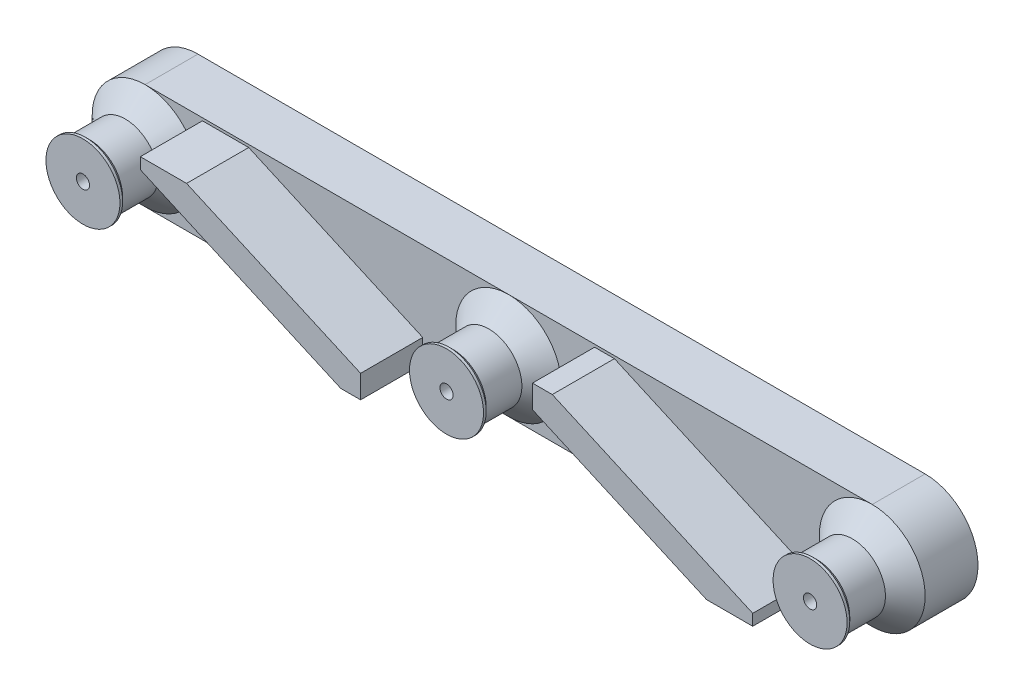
SolidWorks part; units mm, degrees
ref_plane "Alzado" through (0, 0, 0) normal (0, 0, 1) x (1, 0, 0)
ref_plane "Planta" through (0, 0, 0) normal (0, 1, 0) x (1, 0, 0)
ref_plane "Vista lateral" through (0, 0, 0) normal (1, 0, 0) x (0, 0, -1)
sketch "Sketch1" plane through (0, 0, 0) normal (0, 0, 1) x (1, 0, 0)
  line L0 (-27.5, 0) -> (27.5, 0) construction
  line L1 (-27.5, 4) -> (27.5, 4)
  line L2 (-27.5, -4) -> (27.5, -4)
  arc A0 (-27.5, 4) -> (-27.5, -4) centre (-27.5, 0) ccw
  arc A1 (27.5, -4) -> (27.5, 4) centre (27.5, 0) ccw
  point P3 (0, 0)
extrude "Boss-Extrude1" add sketch "Sketch1" along normal blind 4
sketch "Sketch2" plane through (0, 0, 4) normal (0, 0, 1) x (1, 0, 0)
  circle A0 centre (-27.5, 0) radius 4
extrude "Boss-Extrude2" add sketch "Sketch2" along normal blind 1.5
chamfer "Chamfer1" distance 1.5 angle 45 1 edges at (-23.5, 0, 5.5)
sketch "Sketch3" plane through (0, 0, 5.5) normal (0, 0, 1) x (1, 0, 0)
  circle A0 centre (-27.5, 0) radius 2.5
  circle A1 centre (-27.5, 0) radius 2.5 construction
extrude "Boss-Extrude3" add sketch "Sketch3" along normal blind 2
sketch "Sketch4" plane through (0, 0, 7.5) normal (0, 0, 1) x (1, 0, 0)
  circle A0 centre (-27.5, 0) radius 2.8
  circle A1 centre (-27.5, 0) radius 2.5 construction
extrude "Boss-Extrude4" add sketch "Sketch4" along normal blind 1.2
chamfer "Chamfer2" distance 1 angle 45 1 edges at (-24.7, 0, 7.5)
mirror "Mirror5" about plane through (0, 0, 0) normal (1, 0, 0) of "Boss-Extrude4", "Boss-Extrude3", "Boss-Extrude2"
chamfer "Chamfer3" distance 1.5 angle 45 1 edges at (23.5, 0, 5.5)
chamfer "Chamfer4" distance 1 angle 45 1 edges at (24.7, 0, 7.5)
ref_plane "Plane1" through (-13.75, 0, 0) normal (1, 0, 0) x (0, 0, -1)
mirror "Mirror6" about plane through (-13.75, 0, 0) normal (1, 0, 0) of "Boss-Extrude4", "Boss-Extrude3", "Boss-Extrude2"
chamfer "Chamfer5" distance 1 angle 45 1 edges at (-2.8, 0, 7.5)
chamfer "Chamfer6" distance 1.5 angle 45 1 edges at (-4, 0, 5.5)
sketch "Sketch5" plane through (0, 0, 0) normal (0, 0, -1) x (-1, 0, 0)
  circle A0 centre (-27.5, 0) radius 0.5
  circle A1 centre (0, 0) radius 0.5
  circle A2 centre (27.5, 0) radius 0.5
extrude "Cut-Extrude2" cut sketch "Sketch5" against normal blind 9.5
sketch "Sketch6" plane through (0, 0, 4) normal (0, 0, 1) x (1, 0, 0)
  line L2 (-6.5, -3.8) -> (-6.5, -2.0596)
  line L3 (-6.5, -2.0596) -> (-19.661, 3.8)
  line L5 (-19.661, 3.8) -> (-23.161, 3.8)
  line L6 (-23.161, 3.8) -> (-23.161, 2.9501)
  line L7 (-23.161, 2.9501) -> (-8, -3.8)
  line L8 (-8, -3.8) -> (-6.5, -3.8)
  line L9 (-27.5, -4) -> (0, -4) construction
  line L10 (0, 4) -> (-27.5, 4) construction
  dimension "D1" = 156
  dimension "D2" = 2.2
  dimension "D3" = 0.2
  dimension "D4" = 0.2
  dimension "D5" = 3.5
  dimension "D6" = 1.5
  dimension "D7" = 6.5
extrude "Boss-Extrude5" add sketch "Sketch6" along normal up to surface (4.7 mm away)
mirror "Mirror7" about plane through (0, 0, 0) normal (0, 1, 0) of "Boss-Extrude5"
sketch "Sketch7" plane through (0, 0, 8.7) normal (0, 0, 1) x (1, 0, 0)
  line L0 (-14.8544, 1.66) -> (-8.3443, -1.2385)
  line L1 (-13.8305, 1.2041) -> (-19.661, 3.8) construction
  line L2 (-6.5, -2.0596) -> (-11.126, 0) construction
  line L3 (-8.3443, -1.2385) -> (-4.9598, 1.7717)
  line L4 (-4.9598, 1.7717) -> (-5.6268, 5.2784)
  line L5 (-5.6268, 5.2784) -> (-14.8544, 1.66)
  line L6 (-17.0737, 0.2399) -> (-11.6017, -2.1964)
  line L7 (-23.161, 2.9501) -> (-16.5349, 0) construction
  line L8 (-13.8305, -1.2041) -> (-8, -3.8) construction
  line L9 (-11.6017, -2.1964) -> (-20.9225, -7.7318)
  line L10 (-20.9225, -7.7318) -> (-24.559, -3.6433)
  line L11 (-24.559, -3.6433) -> (-22.1459, -0.5196)
  line L12 (-22.1459, -0.5196) -> (-17.0737, 0.2399)
  line L13 (8.9056, 0.9886) -> (14.8337, -1.6507)
  line L14 (6.5, 2.0596) -> (11.126, 0) construction
  line L15 (13.8305, -1.2041) -> (19.661, -3.8) construction
  line L16 (14.8337, -1.6507) -> (7.5401, -4.9541)
  line L17 (7.5401, -4.9541) -> (5.0997, -4.3744)
  line L18 (5.0997, -4.3744) -> (5.0353, -0.6172)
  line L19 (5.0353, -0.6172) -> (8.9056, 0.9886)
  line L20 (11.9995, 2.0193) -> (18.9185, -1.0612)
  line L21 (13.8305, 1.2041) -> (8, 3.8) construction
  line L22 (23.161, -2.9501) -> (16.5349, 0) construction
  line L23 (18.9185, -1.0612) -> (24.031, 3.232)
  line L24 (24.031, 3.232) -> (23.4042, 6.2356)
  line L25 (23.4042, 6.2356) -> (16.1646, 4.7249)
  line L26 (16.1646, 4.7249) -> (11.9995, 2.0193)
extrude "Cut-Extrude5" cut sketch "Sketch7" against normal up to surface (4.7 mm away)
equation "\"largo\"= 55"
equation "\"D1@Sketch1\"=\"largo\""
equation "\"ancho\"= 8"
equation "\"D2@Sketch1\"=\"ancho\""
equation "\"thick\"= 4"
equation "\"D1@Boss-Extrude1\"=\"thick\""
equation "\"D1@Sketch2\"=\"largo\"/2"
equation "\"thick_c\"= 1.5"
equation "\"c\"= 8"
equation "\"c1\"= 5.6"
equation "\"D2@Sketch2\"=\"c\""
equation "\"D1@Boss-Extrude2\"=\"thick_c\""
equation "\"alto_c\"= 2"
equation "\"D1@Boss-Extrude3\"=\"alto_c\""
equation "\"D1@Sketch4\"=\"c1\""
equation "\"c_mini\"= 1"
equation "\"D1@Sketch5\"=\"c_mini\""
equation "\"D2@Sketch5\"=\"largo\"/2"
equation "\"D3@Sketch5\"=\"c_mini\""
equation "\"D4@Sketch5\"=\"c_mini\""
equation "\"chan_1\"= 1.5"
equation "\"chan_2\"= 1"
equation "\"D1@Chamfer1\"=\"chan_1\""
equation "\"D1@Chamfer3\"=\"chan_1\""
equation "\"D1@Chamfer6\"=\"chan_1\""
